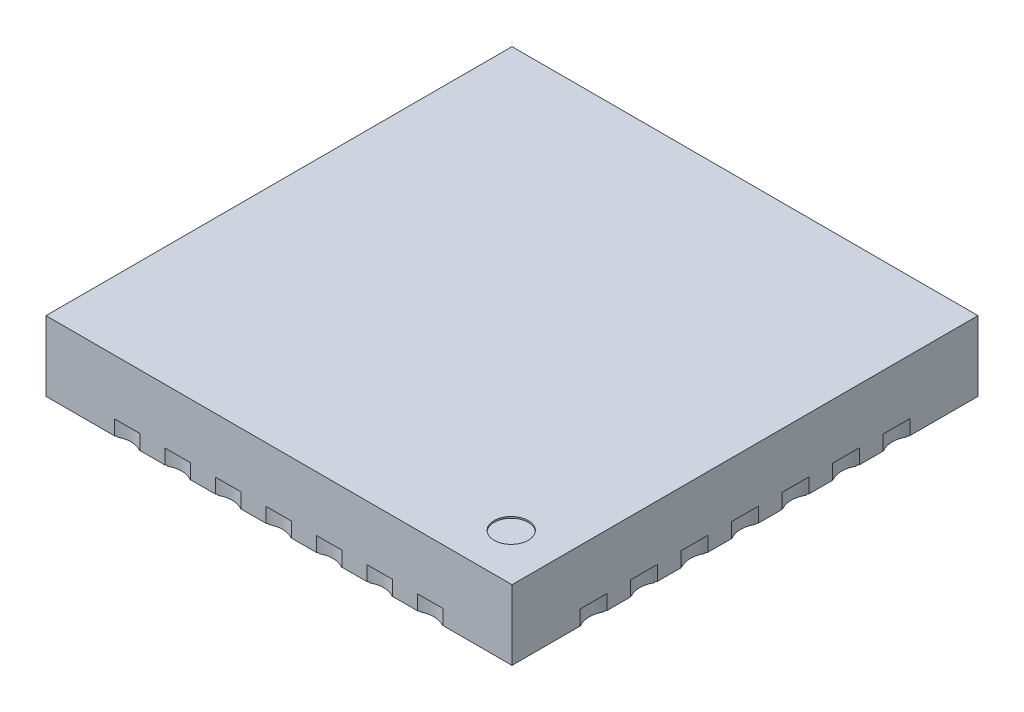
SolidWorks part; units mm, degrees
ref_plane "Plane1" through (0, 0, 0) normal (0, 0, 1) x (1, 0, 0)
ref_plane "Plane2" through (0, 0, 0) normal (0, 1, 0) x (1, 0, 0)
ref_plane "Plane3" through (0, 0, 0) normal (1, 0, 0) x (0, 0, -1)
sketch "Sketch1" plane through (0, 0, 0) normal (0, 1, 0) x (1, 0, 0)
  line L1 (0, 0) -> (6, 0)
  line L2 (0, 0) -> (0, 6)
  line L3 (0, 6) -> (6, 6)
  line L4 (6, 0) -> (6, 6)
  dimension "D1" = 6
  dimension "D2" = 6
extrude "Base-Extrude" add sketch "Sketch1" along normal blind 0.9
sketch "Sketch2" plane through (0, 0, 0) normal (0, -1, 0) x (1, 0, 0)
  line L0 (0.8008, -0.8) -> (5.2008, -0.8)
  line L1 (5.2008, -0.8) -> (5.2008, -5.2)
  line L2 (5.2008, -5.2) -> (0.8008, -5.2)
  line L3 (0.8008, -5.2) -> (0.8008, -0.8)
  line L4 (6, 0) -> (6, -6) construction
  line L5 (0, 0) -> (6, 0) construction
  line L6 (0.0008, -3.5) -> (0.5008, -3.5)
  line L7 (0.5008, -3.5) -> (0.5008, -3.8)
  line L8 (0.5008, -3.8) -> (0.0008, -3.8)
  line L9 (0.0008, -3.8) -> (0.0008, -3.5)
  line L11 (1.8508, -6) -> (1.8508, -5.5)
  line L12 (1.8508, -5.5) -> (1.5508, -5.5)
  line L13 (1.5508, -5.5) -> (1.5508, -6)
  line L14 (1.5508, -6) -> (1.8508, -6)
  line L15 (1.2008, -6) -> (1.2008, -5.5)
  line L16 (1.2008, -5.5) -> (0.9008, -5.5)
  line L17 (0.9008, -5.5) -> (0.9008, -6)
  line L18 (0.9008, -6) -> (1.2008, -6)
  line L19 (0.0008, -4.8) -> (0.5008, -4.8)
  line L20 (0.5008, -4.8) -> (0.5008, -5.1)
  line L21 (0.5008, -5.1) -> (0.0008, -5.1)
  line L22 (0.0008, -5.1) -> (0.0008, -4.8)
  line L23 (0.0008, -4.15) -> (0.5008, -4.15)
  line L24 (0.5008, -4.15) -> (0.5008, -4.45)
  line L25 (0.5008, -4.45) -> (0.0008, -4.45)
  line L26 (0.0008, -4.45) -> (0.0008, -4.15)
  line L27 (5.47, -0.1167) -> (5.87, -0.1167)
  line L28 (5.87, -0.1167) -> (5.87, -0.5167)
  line L29 (5.87, -0.5167) -> (5.47, -0.5167)
  line L30 (5.47, -0.5167) -> (5.47, -0.1167)
  line L31 (0.9008, 0) -> (1.2008, 0)
  line L32 (0.9008, -0.5) -> (0.9008, 0)
  line L33 (1.2008, 0) -> (1.2008, -0.5)
  line L34 (1.2008, -0.5) -> (0.9008, -0.5)
  line L35 (1.5508, 0) -> (1.8508, 0)
  line L36 (1.5508, -0.5) -> (1.5508, 0)
  line L37 (1.8508, 0) -> (1.8508, -0.5)
  line L38 (1.8508, -0.5) -> (1.5508, -0.5)
  line L39 (0.0008, -0.9) -> (0.5008, -0.9)
  line L40 (0.5008, -0.9) -> (0.5008, -1.2)
  line L41 (0.5008, -1.2) -> (0.0008, -1.2)
  line L42 (0.0008, -1.2) -> (0.0008, -0.9)
  line L43 (0.0008, -1.55) -> (0.5008, -1.55)
  line L44 (0.5008, -1.55) -> (0.5008, -1.85)
  line L45 (0.5008, -1.85) -> (0.0008, -1.85)
  line L46 (0.0008, -1.85) -> (0.0008, -1.55)
  line L47 (0.0008, -2.2) -> (0.5008, -2.2)
  line L48 (0.5008, -2.2) -> (0.5008, -2.5)
  line L49 (0.5008, -2.5) -> (0.0008, -2.5)
  line L50 (0.0008, -2.5) -> (0.0008, -2.2)
  line L51 (0.0008, -2.85) -> (0.5008, -2.85)
  line L52 (0.5008, -2.85) -> (0.5008, -3.15)
  line L53 (0.5008, -3.15) -> (0.0008, -3.15)
  line L54 (0.0008, -3.15) -> (0.0008, -2.85)
  line L55 (5.5008, -3.5) -> (5.5008, -3.8)
  line L56 (6.0008, -3.8) -> (6.0008, -3.5)
  line L58 (5.5008, -3.8) -> (6.0008, -3.8)
  line L59 (5.5008, -4.15) -> (5.5008, -4.45)
  line L60 (6.0008, -4.15) -> (5.5008, -4.15)
  line L61 (5.5008, -4.45) -> (6.0008, -4.45)
  line L62 (6.0008, -4.45) -> (6.0008, -4.15)
  line L63 (5.5008, -4.8) -> (5.5008, -5.1)
  line L64 (6.0008, -4.8) -> (5.5008, -4.8)
  line L65 (5.5008, -5.1) -> (6.0008, -5.1)
  line L66 (6.0008, -5.1) -> (6.0008, -4.8)
  line L67 (3.8008, -6) -> (3.8008, -5.5)
  line L68 (3.8008, -5.5) -> (3.5008, -5.5)
  line L69 (3.5008, -5.5) -> (3.5008, -6)
  line L70 (3.5008, -6) -> (3.8008, -6)
  line L71 (4.4508, -6) -> (4.4508, -5.5)
  line L72 (4.4508, -5.5) -> (4.1508, -5.5)
  line L73 (4.1508, -5.5) -> (4.1508, -6)
  line L74 (4.1508, -6) -> (4.4508, -6)
  line L75 (5.1008, -6) -> (5.1008, -5.5)
  line L76 (5.1008, -5.5) -> (4.8008, -5.5)
  line L77 (4.8008, -5.5) -> (4.8008, -6)
  line L78 (4.8008, -6) -> (5.1008, -6)
  line L79 (3.1508, -6) -> (3.1508, -5.5)
  line L80 (3.1508, -5.5) -> (2.8508, -5.5)
  line L81 (2.8508, -5.5) -> (2.8508, -6)
  line L82 (2.8508, -6) -> (3.1508, -6)
  line L83 (2.5008, -6) -> (2.5008, -5.5)
  line L84 (2.5008, -5.5) -> (2.2008, -5.5)
  line L85 (2.2008, -5.5) -> (2.2008, -6)
  line L86 (2.2008, -6) -> (2.5008, -6)
  line L87 (6.0008, -0.9) -> (5.5008, -0.9)
  line L88 (6.0008, -3.15) -> (6.0008, -2.85)
  line L89 (5.5008, -3.15) -> (6.0008, -3.15)
  line L90 (6.0008, -2.85) -> (5.5008, -2.85)
  line L91 (5.5008, -2.85) -> (5.5008, -3.15)
  line L92 (5.5008, -2.2) -> (5.5008, -2.5)
  line L93 (6.0008, -2.2) -> (5.5008, -2.2)
  line L94 (5.5008, -2.5) -> (6.0008, -2.5)
  line L95 (6.0008, -2.5) -> (6.0008, -2.2)
  line L96 (5.5008, -1.55) -> (5.5008, -1.85)
  line L97 (6.0008, -1.55) -> (5.5008, -1.55)
  line L98 (5.5008, -1.85) -> (6.0008, -1.85)
  line L99 (6.0008, -1.85) -> (6.0008, -1.55)
  line L100 (5.5008, -1.2) -> (6.0008, -1.2)
  line L101 (6.0008, -3.5) -> (5.5008, -3.5)
  line L102 (5.5008, -0.9) -> (5.5008, -1.2)
  line L103 (6.0008, -1.2) -> (6.0008, -0.9)
  line L104 (2.2008, 0) -> (2.5008, 0)
  line L105 (2.2008, -0.5) -> (2.2008, 0)
  line L106 (2.5008, 0) -> (2.5008, -0.5)
  line L107 (2.5008, -0.5) -> (2.2008, -0.5)
  line L108 (4.8008, 0) -> (5.1008, 0)
  line L109 (4.8008, -0.5) -> (4.8008, 0)
  line L110 (5.1008, 0) -> (5.1008, -0.5)
  line L111 (5.1008, -0.5) -> (4.8008, -0.5)
  line L112 (4.1508, 0) -> (4.4508, 0)
  line L113 (4.1508, -0.5) -> (4.1508, 0)
  line L114 (4.4508, 0) -> (4.4508, -0.5)
  line L115 (4.4508, -0.5) -> (4.1508, -0.5)
  line L116 (3.5008, 0) -> (3.8008, 0)
  line L117 (3.5008, -0.5) -> (3.5008, 0)
  line L118 (3.8008, 0) -> (3.8008, -0.5)
  line L119 (3.8008, -0.5) -> (3.5008, -0.5)
  line L120 (2.8508, -0.5) -> (2.8508, 0)
  line L121 (3.1508, 0) -> (3.1508, -0.5)
  line L122 (2.8508, 0) -> (3.1508, 0)
  line L123 (3.1508, -0.5) -> (2.8508, -0.5)
  circle A0 centre (3, -3) radius 0.005
  dimension "D2" = 3
  dimension "D3" = 0.01
  dimension "D1" = 3
extrude "Boss-Extrude1" add sketch "Sketch2" along normal blind 0.01
sketch "Sketch3" plane through (0, -0.01, 0) normal (0, -1, 0) x (1, 0, 0)
  line L3 (3.1508, 0) -> (3.5008, 0) construction
  circle A0 centre (4.9459, 0.25) radius 0.3
  circle A1 centre (4.2959, 0.25) radius 0.3
  circle A2 centre (3.6459, 0.25) radius 0.3
  circle A3 centre (2.9959, 0.25) radius 0.3
  circle A4 centre (2.3459, 0.25) radius 0.3
  circle A5 centre (1.6959, 0.25) radius 0.3
  circle A6 centre (1.0459, 0.25) radius 0.3
  circle A7 centre (4.9459, -6.25) radius 0.3
  circle A8 centre (4.2959, -6.25) radius 0.3
  circle A9 centre (3.6459, -6.25) radius 0.3
  circle A10 centre (2.9959, -6.25) radius 0.3
  circle A11 centre (2.3459, -6.25) radius 0.3
  circle A12 centre (1.6959, -6.25) radius 0.3
  circle A13 centre (1.0459, -6.25) radius 0.3
  circle A14 centre (-0.2541, -1.05) radius 0.3
  circle A15 centre (6.2459, -1.7) radius 0.3
  circle A16 centre (6.2459, -1.05) radius 0.3
  circle A17 centre (-0.2541, -1.7) radius 0.3
  circle A18 centre (6.2459, -2.35) radius 0.3
  circle A19 centre (-0.2541, -2.35) radius 0.3
  circle A20 centre (6.2459, -3) radius 0.3
  circle A21 centre (-0.2541, -3) radius 0.3
  circle A22 centre (6.2459, -3.65) radius 0.3
  circle A23 centre (-0.2541, -3.65) radius 0.3
  circle A24 centre (6.2459, -4.3) radius 0.3
  circle A25 centre (-0.2541, -4.3) radius 0.3
  circle A26 centre (6.2459, -4.95) radius 0.3
  circle A27 centre (-0.2541, -4.95) radius 0.3
  dimension "D1" = 0.6
  dimension "D2" = 0.25
extrude "Cut-Extrude1" cut sketch "Sketch3" against normal blind 0.2
sketch "Sketch5" plane through (0, 0.9, 0) normal (0, 1, 0) x (-1, 0, 0)
  line L0 (0, 0) -> (-6, 0) construction
  line L1 (-6, 0) -> (-6, -6) construction
  circle A0 centre (-5.39, -0.6) radius 0.22
  dimension "D2" = 0.61
  dimension "D1" = 0.6
extrude "Cut-Extrude3" cut sketch "Sketch5" against normal blind 0.02
sketch "Sketch6" plane through (0, -0.01, 0) normal (0, -1, 0) x (1, 0, 0)
  line L0 (6, -5.1219) -> (6, -6) construction
  line L1 (4.5, -1.5) -> (1.5, -1.5)
  line L2 (4.5, -1.5) -> (4.5, -4.5)
  line L3 (4.5, -4.5) -> (1.5, -4.5)
  line L4 (1.5, -1.5) -> (1.5, -4.5)
  line L5 (0.8801, -6) -> (0, -6) construction
  dimension "D1" = 3
  dimension "D2" = 3
  dimension "D3" = 1.5
  dimension "D4" = 1.5
extrude "Cut-Extrude4" cut sketch "Sketch6" against normal blind 0.55
sketch "Sketch7" plane through (0, -0.01, 0) normal (0, -1, 0) x (1, 0, 0)
  line L1 (5.2008, -0.8) -> (0.8008, -0.8)
  line L2 (5.2008, -0.8) -> (5.2008, -5.2)
  line L3 (5.2008, -5.2) -> (0.8008, -5.2)
  line L4 (0.8008, -0.8) -> (0.8008, -5.2)
extrude "Boss-Extrude2" add sketch "Sketch7" against normal blind 0.3
